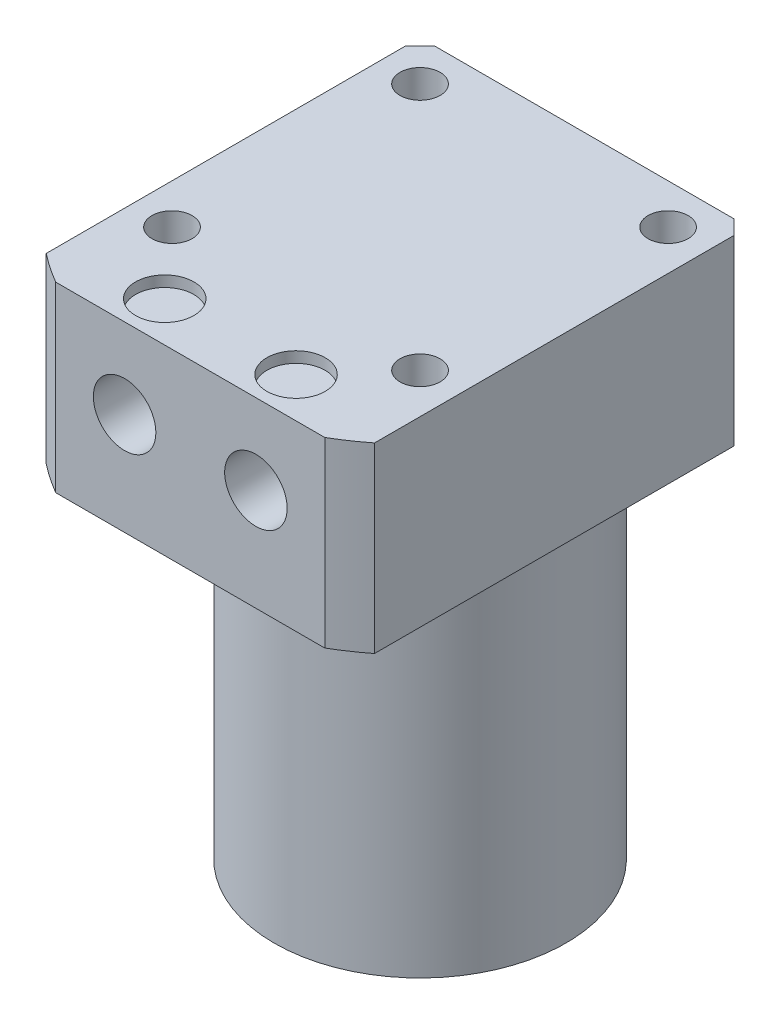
SolidWorks part; units mm, degrees
ref_plane "Front Plane" through (0, 0, 0) normal (0, 0, 1) x (1, 0, 0)
ref_plane "Top Plane" through (0, 0, 0) normal (0, 1, 0) x (1, 0, 0)
ref_plane "Right Plane" through (0, 0, 0) normal (1, 0, 0) x (0, 0, -1)
sketch "Sketch1" plane through (0, 0, 0) normal (0, 0, 1) x (1, 0, 0)
  line L0 (0, 87.0508) -> (0, 0) construction
  line L1 (0, 0) -> (-20, 0)
  line L2 (-20, 0) -> (-20, 50)
  line L3 (-20, 50) -> (-36.5, 50)
  line L4 (-36.5, 50) -> (-36.5, 75)
  line L6 (-36.5, 75) -> (0, 75)
  line L7 (0, 0) -> (0, 75)
  dimension "D1" = 20
  dimension "D2" = 50
  dimension "D3" = 36.5
  dimension "D5" = 25
revolve "Revolve1" add sketch "Sketch1" angle 360 about L0
sketch "Sketch2" plane through (0, 75, 0) normal (0, 1, 0) x (1, 0, 0)
  line L0 (0, 0) -> (0, 22.5) construction
  line L1 (-22.5, 22.5) -> (22.5, 22.5)
  line L2 (-22.5, 22.5) -> (-22.5, -31.5)
  line L3 (-22.5, -31.5) -> (22.5, -31.5)
  line L4 (22.5, 22.5) -> (22.5, -31.5)
  dimension "D1" = 54
  dimension "D2" = 45
  dimension "D3" = 22.5
extrude "Cut-Extrude2" cut sketch "Sketch2" against normal through all flip side to cut
chamfer "Chamfer1" distance 2 angle 45 2 edges at (22.5, 62.5, -22.5) (-22.5, 62.5, -22.5)
hole_wizard "Ø8.0 (8) Diameter Hole1" positions "Sketch4" profile "Sketch3" hole size "Ø8.0" standard "ISO"
sketch "Sketch4" plane through (-22.9405, 75, 22.7051) normal (0, -1, 0) x (1, 0, 0)
  line L0 (13.9405, 3.2949) -> (31.9405, 3.2949) construction
  line L2 (22.9405, 3.2949) -> (22.9405, -22.7051) construction
  point P0 (13.9405, 3.2949)
  point P1 (31.9405, 3.2949)
  dimension "D1" = 18
  dimension "D2" = 26
sketch "Sketch3" plane through (-9, 75, 26) normal (1, 0, 0) x (0, 0, 1)
  line L0 (0, 0) -> (0, 1.5)
  line L1 (0, 1.5) -> (4, 1.5)
  line L2 (4, 1.5) -> (4, 0)
  line L5 (4, 0) -> (0, 0)
  line L10 (0, 1.5) -> (-4, 1.5) construction
  line L11 (0, -6.35) -> (0, 107.95) construction
  dimension "Hole Dia." = 8
  dimension "Hole Depth" = 1.5
  dimension "Drill Angle" = 180
hole_wizard "G1/8 Tapped Hole1" positions "Sketch6" profile "Sketch5" tap size "G1/8" standard "ISO"
sketch "Sketch6" plane through (0, 0, 31.5) normal (0, 0, 1) x (1, 0, 0)
  line L0 (-9, 64) -> (9, 64) construction
  line L4 (0, 64) -> (0, 75) construction
  line L5 (-18.4391, 75) -> (18.4391, 75) construction
  point P0 (-9, 64)
  point P1 (9, 64)
  dimension "D1" = 11
  dimension "D2" = 18
sketch "Sketch5" plane through (-9, 64, 31.5) normal (1, 0, 0) x (0, -1, 0)
  line L0 (0, 0) -> (0, 22.18)
  line L1 (0, 22.18) -> (4.283, 22.18)
  line L2 (4.283, 22.18) -> (4.283, 0)
  line L5 (4.283, 0) -> (0, 0)
  line L10 (0, 22.18) -> (-4.283, 22.18) construction
  line L11 (0, -6.35) -> (0, 107.95) construction
  dimension "Tap Drill Dia." = 8.566
  dimension "Tap Drill Depth" = 22.18
  dimension "Drill Angle" = 180
hole_wizard "Ø5.5 (5.5) Diameter Hole1" positions "Sketch8" profile "Sketch7" hole size "Ø5.5" standard "ISO"
sketch "Sketch8" plane through (-33.2535, 50, 49.2524) normal (0, 1, 0) x (-1, 0, 0)
  line L1 (-16.2535, -32.2524) -> (-50.2535, -32.2524)
  line L2 (-16.2535, -32.2524) -> (-16.2535, -66.2524)
  line L3 (-16.2535, -66.2524) -> (-50.2535, -66.2524)
  line L4 (-50.2535, -32.2524) -> (-50.2535, -66.2524)
  line L7 (-33.2535, -49.2524) -> (-33.2535, -32.2524) construction
  line L9 (-33.2535, -49.2524) -> (-16.2535, -49.2524) construction
  point P0 (-16.2535, -66.2524)
  point P1 (-50.2535, -66.2524)
  point P3 (-50.2535, -32.2524)
  point P5 (-16.2535, -32.2524)
  dimension "D1" = 34
  dimension "D2" = 34
sketch "Sketch7" plane through (-17, 50, -17) normal (1, 0, 0) x (0, 0, -1)
  line L0 (0, 0) -> (0, 31.5)
  line L1 (0, 31.5) -> (2.75, 31.5)
  line L2 (2.75, 31.5) -> (2.75, 0)
  line L5 (2.75, 0) -> (0, 0)
  line L10 (0, 31.5) -> (-2.75, 31.5) construction
  line L11 (0, -6.35) -> (0, 107.95) construction
  dimension "Hole Dia." = 5.5
  dimension "Hole Depth" = 31.5
  dimension "Drill Angle" = 180
